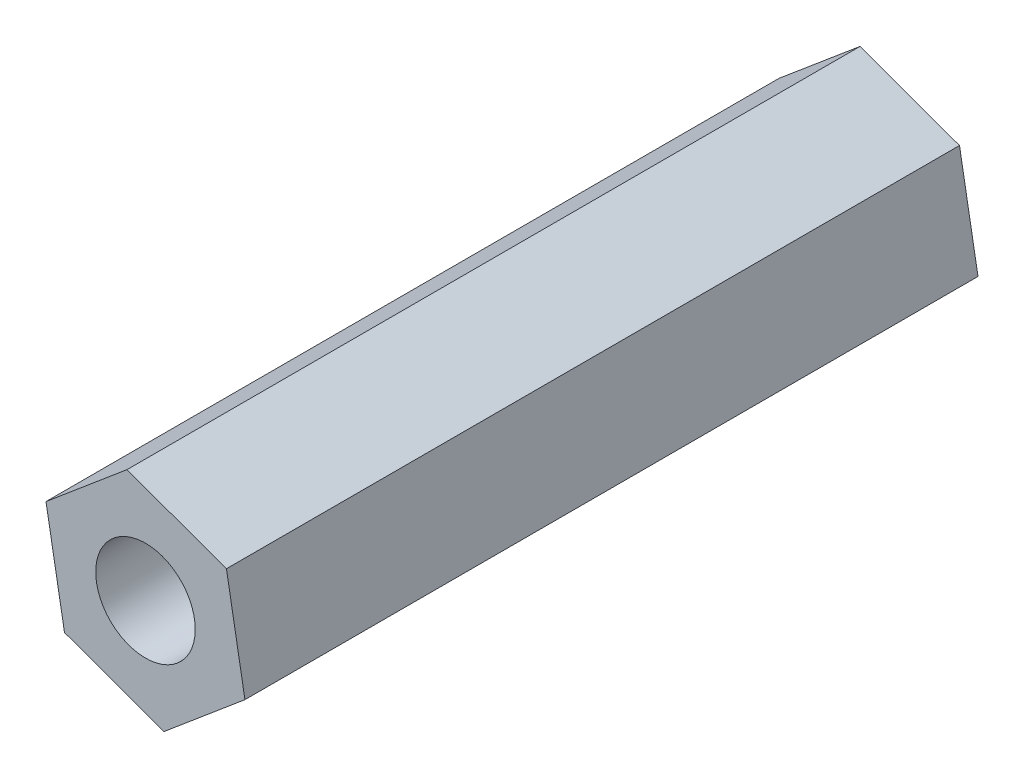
SolidWorks part; units mm, degrees
ref_plane "Front Plane" through (0, 0, 0) normal (0, 0, 1) x (1, 0, 0)
ref_plane "Top Plane" through (0, 0, 0) normal (0, 1, 0) x (1, 0, 0)
ref_plane "Right Plane" through (0, 0, 0) normal (1, 0, 0) x (0, 0, -1)
sketch "Sketch1" plane through (0, 0, 0) normal (0, 0, 1) x (1, 0, 0)
  line L1 (3.4465, -1.25) -> (2.8058, 2.3597)
  line L2 (2.8058, 2.3597) -> (-0.6407, 3.6098)
  line L3 (-0.6407, 3.6098) -> (-3.4465, 1.25)
  line L4 (-3.4465, 1.25) -> (-2.8058, -2.3597)
  line L5 (-2.8058, -2.3597) -> (0.6407, -3.6098)
  line L6 (0.6407, -3.6098) -> (3.4465, -1.25)
  circle A0 centre (0, 0) radius 3.175 construction
  dimension "D1" = 6.35
extrude "Boss-Extrude1" add sketch "Sketch1" along normal blind 25.4
sketch "Sketch2" plane through (0, 0, 25.4) normal (0, 0, 1) x (1, 0, 0)
  circle A0 centre (0, 0) radius 1.7242
extrude "Cut-Extrude1" cut sketch "Sketch2" against normal through all
